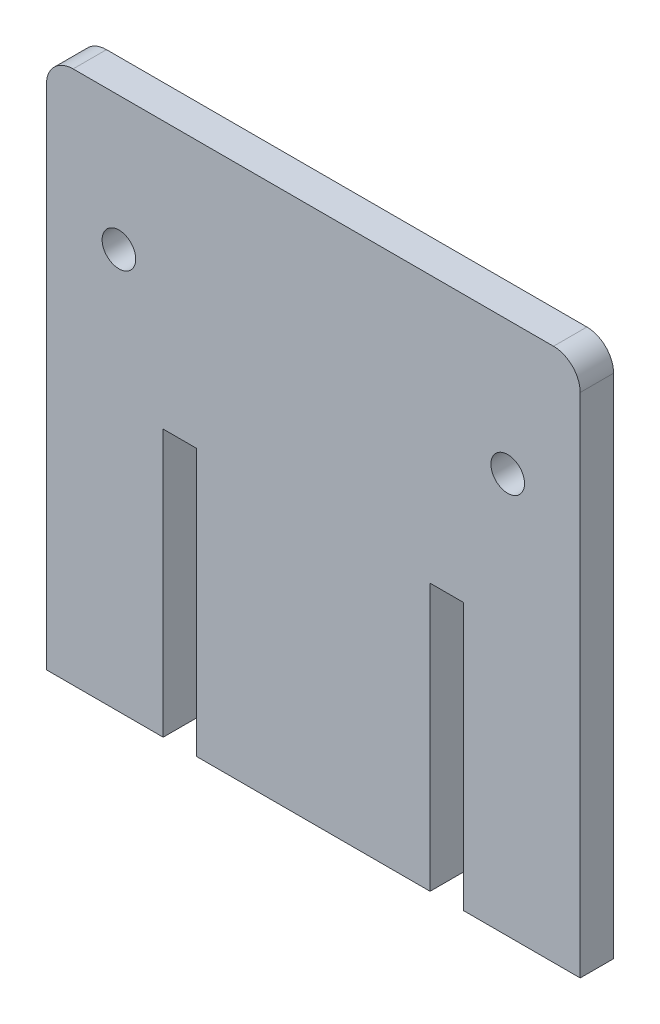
SolidWorks part; units mm, degrees
ref_plane "Front Plane" through (0, 0, 0) normal (0, 0, 1) x (1, 0, 0)
ref_plane "Top Plane" through (0, 0, 0) normal (0, 1, 0) x (1, 0, 0)
ref_plane "Right Plane" through (0, 0, 0) normal (1, 0, 0) x (0, 0, -1)
sketch "Sketch1" plane through (0, 0, 0) normal (0, 0, 1) x (1, 0, 0)
  line L1 (-25.4, 25.4) -> (25.4, 25.4)
  line L2 (-25.4, 25.4) -> (-25.4, -25.4)
  line L3 (-25.4, -25.4) -> (25.4, -25.4)
  line L4 (25.4, 25.4) -> (25.4, -25.4)
  line L5 (-25.4, 25.4) -> (25.4, -25.4) construction
  line L6 (-25.4, -25.4) -> (25.4, 25.4) construction
  point P0 (0, 0)
  dimension "D1" = 50.8
  dimension "D2" = 50.8
extrude "Boss-Extrude1" add sketch "Sketch1" along normal mid plane 3.175
sketch "Sketch2" plane through (0, 0, 1.5875) normal (0, 0, 1) x (1, 0, 0)
  line L0 (0, 55.0741) -> (0, -55.705) construction
  line L2 (-25.4, -25.4) -> (25.4, -25.4) construction
  line L3 (-14.2875, 0) -> (-11.1125, 0)
  line L4 (-14.2875, 0) -> (-14.2875, -25.4)
  line L5 (-14.2875, -25.4) -> (-11.1125, -25.4)
  line L6 (-11.1125, 0) -> (-11.1125, -25.4)
  line L7 (-14.2875, 0) -> (-11.1125, -25.4) construction
  line L8 (-14.2875, -25.4) -> (-11.1125, 0) construction
  line L9 (14.2875, -25.4) -> (11.1125, 0) construction
  line L10 (14.2875, 0) -> (11.1125, -25.4) construction
  line L11 (11.1125, 0) -> (11.1125, -25.4)
  line L12 (14.2875, -25.4) -> (11.1125, -25.4)
  line L13 (14.2875, 0) -> (14.2875, -25.4)
  line L14 (14.2875, 0) -> (11.1125, 0)
  point P3 (-12.7, -12.7)
  point P14 (12.7, -12.7)
  dimension "D1" = 25.4
  dimension "D2" = 3.175
  dimension "D3" = 12.7
extrude "Cut-Extrude1" cut sketch "Sketch2" against normal through all
fillet "Fillet1" radius 2.54 2 edges at (25.4, 25.4, 0) (-25.4, 25.4, 0)
sketch "Sketch3" plane through (0, 0, 1.5875) normal (0, 0, 1) x (1, 0, 0)
  line L0 (22.86, 25.4) -> (-22.86, 25.4) construction
  line L1 (0, -27.4088) -> (0, 27.7249) construction
  circle A0 centre (-18.5014, 12.7) radius 1.6002
  circle A1 centre (18.5014, 12.7) radius 1.6002
  dimension "D1" = 3.2004
  dimension "D2" = 18.5014
  dimension "D3" = 12.7
extrude "Cut-Extrude2" cut sketch "Sketch3" against normal through all
